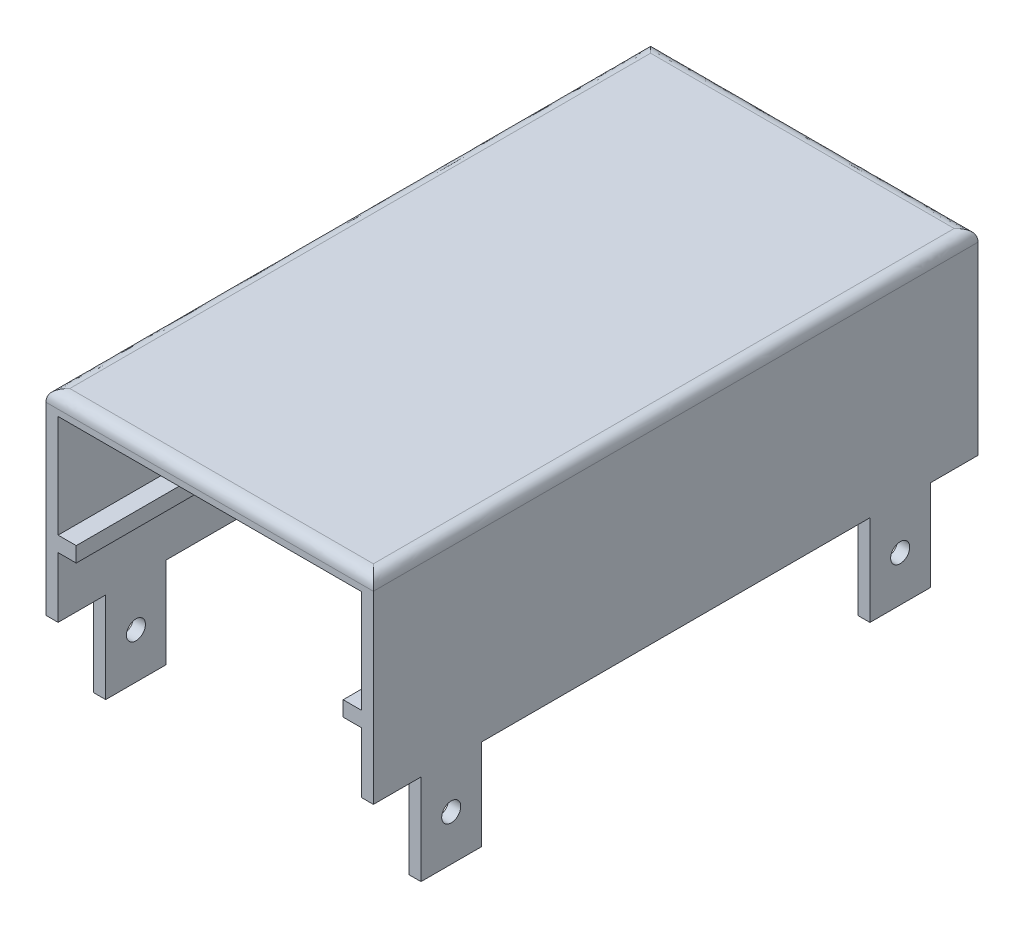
SolidWorks part; units mm, degrees
ref_plane "Front Plane" through (0, 0, 0) normal (0, 0, 1) x (1, 0, 0)
ref_plane "Top Plane" through (0, 0, 0) normal (0, 1, 0) x (1, 0, 0)
ref_plane "Right Plane" through (0, 0, 0) normal (1, 0, 0) x (0, 0, -1)
sketch "Sketch1" plane through (0, 0, 0) normal (0, 0, 1) x (1, 0, 0)
  line L0 (-37.5298, -14.4106) -> (-37.5298, 17.3394)
  line L1 (-32.4498, 17.3394) -> (-24.8298, 17.3394)
  line L2 (100.0124, 17.3394) -> (100.0124, -14.4106)
  line L3 (100.0124, -14.4106) -> (94.9324, -14.4106)
  line L4 (94.9324, -14.4106) -> (94.9324, 10.9894)
  line L5 (94.9324, 10.9894) -> (87.3124, 10.9894)
  line L6 (-32.4498, 10.9894) -> (-32.4498, -14.4106)
  line L7 (-32.4498, -14.4106) -> (-37.5298, -14.4106)
  line L10 (-32.4498, 60.5194) -> (-32.4498, 17.3394)
  line L13 (94.9324, 60.5194) -> (94.9324, 17.3394)
  line L14 (-24.8298, 10.9894) -> (-24.8298, 17.3394)
  line L15 (87.3124, 17.3394) -> (87.3124, 10.9894)
  line L16 (-24.8298, 10.9894) -> (-32.4498, 10.9894)
  line L17 (87.3124, 17.3394) -> (94.9324, 17.3394)
  line L18 (94.9324, 60.5194) -> (-32.4498, 60.5194)
  line L19 (-37.5298, 68.1394) -> (100.0124, 68.1394)
  line L23 (-37.5298, 68.1394) -> (-37.5298, 17.3394)
  line L24 (100.0124, 17.3394) -> (100.0124, 68.1394)
  dimension "D1" = 5.08
  dimension "D2" = 5.08
  dimension "D3" = 6.35
  dimension "D4" = 25.4
  dimension "D5" = 25.4
  dimension "D8" = 12.7
  dimension "D9" = 12.7
extrude "Boss-Extrude1" add sketch "Sketch1" along normal blind 254
fillet "Fillet2" radius 5 4 edges at (100.0124, 68.1394, 127) (31.2413, 68.1394, 254) (-37.5298, 68.1394, 127) (31.2413, 68.1394, 0)
ref_plane "Plane1" through (31.2413, 0, 0) normal (-1, 0, 0) x (0, 0, 1)
sketch "Sketch3" plane through (0, -14.4106, 0) normal (0, -1, 0) x (1, 0, 0)
  line L0 (-37.5298, 254) -> (-37.5298, 0) construction
  line L1 (-37.5298, 234) -> (-32.4498, 234)
  line L2 (-37.5298, 234) -> (-37.5298, 208.6)
  line L3 (-37.5298, 208.6) -> (-32.4498, 208.6)
  line L4 (-32.4498, 234) -> (-32.4498, 208.6)
  line L5 (-32.4498, 254) -> (-32.4498, 0) construction
  line L6 (-37.5298, 0) -> (-32.4498, 0) construction
  line L7 (-37.5298, 45.4) -> (-32.4498, 45.4)
  line L8 (-37.5298, 45.4) -> (-37.5298, 20)
  line L9 (-37.5298, 20) -> (-32.4498, 20)
  line L10 (-32.4498, 45.4) -> (-32.4498, 20)
  line L11 (-37.5298, 254) -> (-32.4498, 254) construction
  line L12 (31.2413, 42.6663) -> (31.2413, -42.6663) construction
  line L13 (100.0124, 20) -> (94.9324, 20)
  line L14 (94.9324, 45.4) -> (94.9324, 20)
  line L15 (100.0124, 45.4) -> (94.9324, 45.4)
  line L16 (100.0124, 45.4) -> (100.0124, 20)
  line L17 (100.0124, 208.6) -> (94.9324, 208.6)
  line L18 (94.9324, 234) -> (94.9324, 208.6)
  line L19 (100.0124, 234) -> (94.9324, 234)
  line L20 (100.0124, 234) -> (100.0124, 208.6)
  dimension "D1" = 25.4
  dimension "D2" = 25.4
  dimension "D3" = 20
  dimension "D4" = 20
extrude "Boss-Extrude2" add sketch "Sketch3" along normal blind 38.1
sketch "Sketch4" plane through (100.0124, 0, 0) normal (1, 0, 0) x (0, 0, -1)
  circle A0 centre (-221.3, -33.4606) radius 4
  circle A1 centre (-32.7, -33.4606) radius 4
  dimension "D1" = 8
  dimension "D2" = 8
extrude "Cut-Extrude1" cut sketch "Sketch4" against normal through all both and the other way through all
sketch "Sketch6" plane through (0, 68.1394, 0) normal (0, 1, 0) x (1, 0, 0)
  line L0 (31.2413, 63.6213) -> (31.2413, -63.6213) construction
  line L1 (43.9413, -139.7) -> (18.5413, -139.7)
  line L2 (43.9413, -139.7) -> (43.9413, -114.3)
  line L3 (43.9413, -114.3) -> (18.5413, -114.3)
  line L4 (18.5413, -139.7) -> (18.5413, -114.3)
  line L5 (43.9413, -139.7) -> (18.5413, -114.3) construction
  line L6 (43.9413, -114.3) -> (18.5413, -139.7) construction
  point P0 (31.2413, -127)
  dimension "D1" = 25.4
  dimension "D2" = 25.4
